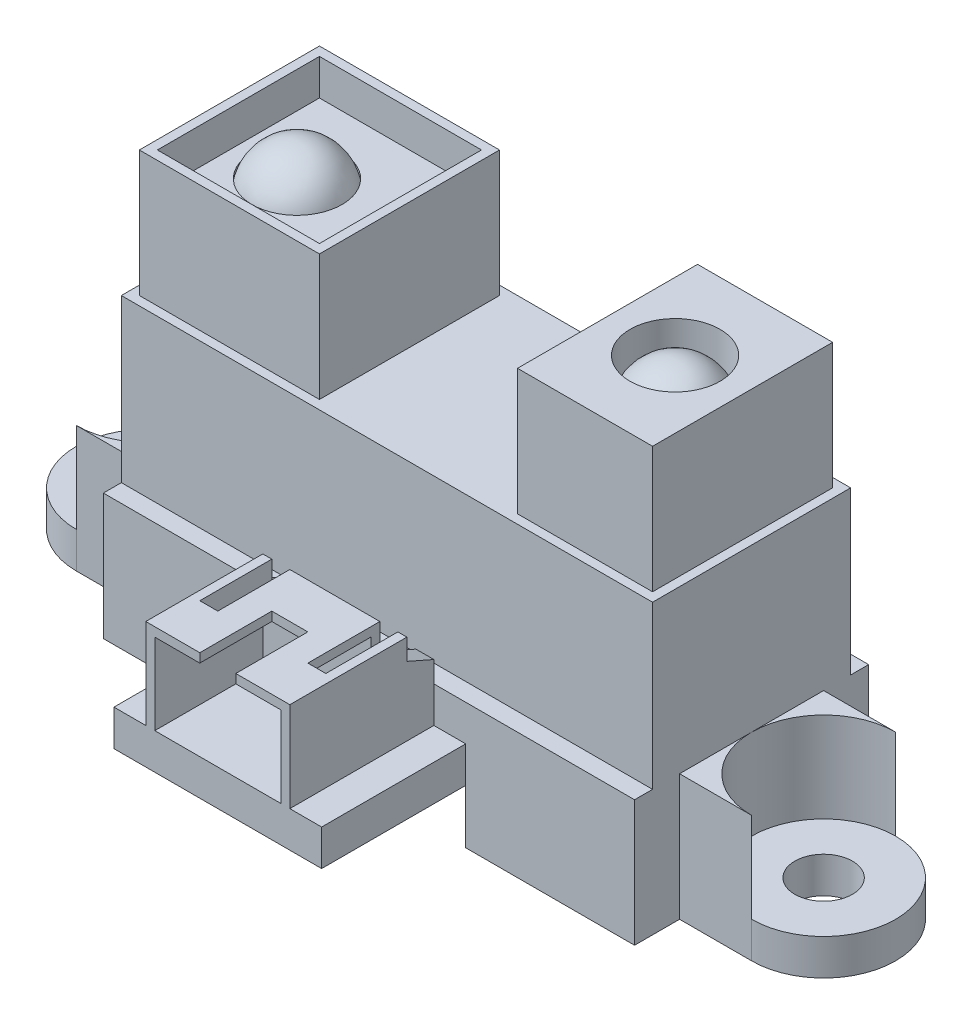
SolidWorks part; units mm, degrees
ref_plane "前视基准面" through (0, 0, 0) normal (0, 0, 1) x (1, 0, 0)
ref_plane "上视基准面" through (0, 0, 0) normal (0, 1, 0) x (1, 0, 0)
ref_plane "右视基准面" through (0, 0, 0) normal (1, 0, 0) x (0, 0, -1)
sketch "草图1" plane through (0, 0, 0) normal (0, 1, 0) x (1, 0, 0)
  line L0 (-8, -6.5) -> (37.5, -6.5) construction
  line L1 (0, 0) -> (29.5, 0)
  line L2 (0, 0) -> (0, -2.5)
  line L3 (0, -13) -> (29.5, -13)
  line L4 (29.5, 0) -> (29.5, -2.5)
  line L5 (-4, -2.5) -> (0, -2.5)
  line L6 (-4, -10.5) -> (0, -10.5)
  line L7 (33.5, -10.5) -> (29.5, -10.5)
  line L8 (33.5, -2.5) -> (29.5, -2.5)
  line L9 (0, -10.5) -> (0, -13)
  line L10 (29.5, -10.5) -> (29.5, -13)
  arc A0 (-4, -2.5) -> (-4, -10.5) centre (-4, -6.5) ccw
  arc A1 (33.5, -10.5) -> (33.5, -2.5) centre (33.5, -6.5) ccw
  dimension "D3" = 8
  dimension "D1" = 13
  dimension "D2" = 29.5
extrude "凸台-拉伸1" add sketch "草图1" along normal blind 7
sketch "草图2" plane through (0, 7, 0) normal (0, 1, 0) x (1, 0, 0)
  line L0 (14.75, 0) -> (14.75, -13) construction
  line L1 (29.5, 0) -> (0, 0) construction
  line L2 (0, -13) -> (29.5, -13) construction
  circle A0 centre (-4, -6.5) radius 4
  circle A1 centre (33.5, -6.5) radius 4
  dimension "D1" = 8
extrude "切除-拉伸1" cut sketch "草图2" against normal blind 5
sketch "草图3" plane through (0, 7, 0) normal (0, 1, 0) x (1, 0, 0)
  line L0 (-4, -6.5) -> (33.8058, -6.5) construction
  line L1 (0, -1) -> (29.5, -1)
  line L2 (0, -1) -> (0, -12)
  line L3 (0, -12) -> (29.5, -12)
  line L4 (29.5, -1) -> (29.5, -12)
  line L5 (14.75, 0) -> (14.75, -13) construction
  line L6 (29.5, 0) -> (0, 0) construction
  line L7 (0, -13) -> (29.5, -13) construction
  dimension "D1" = 11
  dimension "D2" = 29.5
extrude "凸台-拉伸2" add sketch "草图3" along normal blind 9
sketch "草图4" plane through (0, 16, 0) normal (0, 1, 0) x (1, 0, 0)
  line L4 (21.5, -1.5) -> (21.5, -11.5)
  line L5 (10.5, -1.5) -> (10.5, -11.5)
  line L6 (10.5, -1.5) -> (0.5, -1.5)
  line L7 (21.5, -11.5) -> (29, -11.5)
  line L8 (0.5, -1.5) -> (0.5, -11.5)
  line L9 (0.5, -11.5) -> (29, -11.5)
  line L10 (29, -11.5) -> (29, -1.5)
  line L11 (29, -1.5) -> (0.5, -1.5)
  line L12 (0.5, -1.5) -> (0.5, -11.5)
  line L13 (0.5, -11.5) -> (10.5, -11.5)
  line L14 (29, -11.5) -> (29, -1.5)
  line L15 (29, -1.5) -> (21.5, -1.5)
  dimension "D2" = 7.5
  dimension "D3" = 10
  dimension "D1" = 0.5
extrude "凸台-拉伸3" add sketch "草图4" along normal blind 7
sketch "草图5" plane through (0, 23, 0) normal (0, 1, 0) x (1, 0, 0)
  line L8 (1, -2) -> (1, -11)
  line L9 (1, -11) -> (10, -11)
  line L10 (10, -11) -> (10, -2)
  line L11 (10, -2) -> (1, -2)
  line L12 (1, -2) -> (1, -11)
  line L13 (1, -11) -> (10, -11)
  line L14 (10, -11) -> (10, -2)
  line L15 (10, -2) -> (1, -2)
  dimension "D1" = 0.5
extrude "切除-拉伸2" cut sketch "草图5" against normal blind 2
sketch "草图6" plane through (0, 23, 0) normal (0, 1, 0) x (1, 0, 0)
  line L0 (21.5, -1.5) -> (29, -11.5) construction
  line L1 (29, -11.5) -> (29, -1.5) construction
  line L2 (29, -1.5) -> (21.5, -11.5) construction
  circle A0 centre (25.25, -6.5) radius 2.5
  circle A1 centre (4.2533, -6.5) radius 2.5
  dimension "D1" = 5
  dimension "D2" = 20.9967
extrude "切除-拉伸3" cut sketch "草图6" against normal blind 2.2
dome "圆顶1" faces to dome 2 distance 2 parameters "D1"=2
dome "圆顶2" faces to dome 2 distance 2 parameters "D1"=2
sketch "草图7" plane through (0, 2, 0) normal (0, 1, 0) x (1, 0, 0)
  circle A0 centre (-4, -6.5) radius 1.6
  circle A1 centre (33.5, -6.5) radius 1.6
  dimension "D1" = 3.2
extrude "切除-拉伸4" cut sketch "草图7" against normal through all
sketch "草图8" plane through (0, 0, 13) normal (0, 0, 1) x (1, 0, 0)
  line L0 (8.5891, 0) -> (20.1229, 0)
  line L1 (8.5891, 5) -> (20.1229, 5)
  line L2 (8.5891, 5) -> (8.5891, 0)
  line L4 (20.1229, 5) -> (20.1229, 0)
  dimension "D1" = 5
extrude "凸台-拉伸4" add sketch "草图8" along normal blind 8
sketch "草图10" plane through (0, 0, 0) normal (0, -1, 0) x (1, 0, 0)
  line L14 (8.5891, 21) -> (8.5891, 12)
  line L15 (8.5891, 21) -> (20.1229, 21)
  line L16 (20.1229, 21) -> (20.1229, 12)
  line L17 (1, 12) -> (1, 1)
  line L18 (28.5, 1) -> (28.5, 12)
  line L28 (1, 3.5) -> (1, 1)
  line L29 (1, 1) -> (28.5, 1)
  line L30 (28.5, 1) -> (28.5, 3.5)
  line L31 (28.5, 3.5) -> (33.5, 3.5)
  line L32 (33.5, 9.5) -> (28.5, 9.5)
  line L33 (28.5, 9.5) -> (28.5, 12)
  line L34 (28.5, 12) -> (19.1229, 12)
  line L35 (19.1229, 12) -> (19.1229, 20)
  line L36 (19.1229, 20) -> (9.5891, 20)
  line L37 (9.5891, 20) -> (9.5891, 12)
  line L38 (9.5891, 12) -> (1, 12)
  line L39 (1, 12) -> (1, 9.5)
  line L40 (1, 9.5) -> (-4, 9.5)
  line L41 (-4, 3.5) -> (1, 3.5)
  line L43 (1, 1) -> (28.5, 1)
  line L48 (28.5, 12) -> (20.1229, 12)
  line L52 (8.5891, 12) -> (1, 12)
  arc A4 (33.5, 3.5) -> (33.5, 9.5) centre (33.5, 6.5) ccw
  arc A5 (-4, 9.5) -> (-4, 3.5) centre (-4, 6.5) ccw
  dimension "D1" = 1
extrude "切除-拉伸5" cut sketch "草图10" against normal blind 3
sketch "草图11" plane through (0, 5, 0) normal (0, 1, 0) x (1, 0, 0)
  line L0 (14.356, -13) -> (14.356, -21) construction
  line L1 (20.1229, -13) -> (8.5891, -13) construction
  line L2 (20.1229, -21) -> (8.5891, -21) construction
  line L3 (10.356, -14.5) -> (10.356, -21)
  line L4 (18.356, -14.5) -> (18.356, -21)
  line L6 (10.356, -13) -> (10.356, -21) construction
  line L7 (20.1229, -14.5) -> (8.5891, -14.5)
  line L8 (18.356, -14.5) -> (10.356, -14.5)
  line L9 (18.356, -13) -> (18.356, -21) construction
  line L10 (10.356, -21) -> (18.356, -21)
  dimension "D1" = 4
  dimension "D2" = 4
  dimension "D3" = 1.5
extrude "凸台-拉伸6" add sketch "草图11" along normal blind 5
sketch "草图12" plane through (18.356, 0, 0) normal (1, 0, 0) x (0, 0, -1)
  line L0 (-14.5, 8.8329) -> (-13, 8.1725)
  line L1 (-14.5, 10) -> (-14.5, 5) construction
  line L2 (-13, 8.1725) -> (-13, 5)
  line L3 (-13, 5) -> (-14.5, 5)
  line L4 (-14.5, 5) -> (-14.5, 8.8329)
extrude "凸台-拉伸7" add sketch "草图12" against normal blind 1
sketch "草图13" plane through (10.356, 0, 0) normal (-1, 0, 0) x (0, 0, 1)
  line L0 (14.5, 8.8329) -> (13, 8.1725)
  line L1 (13, 8.1725) -> (13, 5)
  line L2 (13, 5) -> (14.5, 5)
  line L3 (14.5, 5) -> (14.5, 8.8329)
extrude "凸台-拉伸8" add sketch "草图13" against normal blind 1
sketch "草图14" plane through (0, 0, 21) normal (0, 0, 1) x (1, 0, 0)
  line L8 (10.856, 5) -> (17.856, 5)
  line L11 (13.356, 10) -> (13.356, 9.5)
  line L12 (15.356, 10) -> (15.356, 9.5)
  line L13 (13.356, 10) -> (15.356, 10)
  line L15 (13.356, 9.5) -> (10.856, 9.5)
  line L16 (9.0891, 3.5) -> (19.6229, 3.5)
  line L17 (19.6229, 3.5) -> (19.6229, 4.5)
  line L18 (19.6229, 4.5) -> (17.856, 4.5)
  line L19 (17.856, 4.5) -> (17.856, 9.5)
  line L20 (17.856, 9.5) -> (10.856, 9.5)
  line L21 (10.856, 9.5) -> (10.856, 4.5)
  line L22 (10.856, 4.5) -> (9.0891, 4.5)
  line L23 (9.0891, 4.5) -> (9.0891, 3.5)
  line L27 (17.856, 5) -> (17.856, 9.5)
  line L28 (17.856, 9.5) -> (15.356, 9.5)
  line L29 (10.856, 9.5) -> (10.856, 5)
  dimension "D1" = 0.5
extrude "切除-拉伸6" cut sketch "草图14" against normal blind 4
sketch "草图15" plane through (0, 0, 17) normal (0, 0, 1) x (1, 0, 0)
  line L1 (10.856, 9.5) -> (17.856, 9.5)
  line L2 (10.856, 9.5) -> (10.856, 5)
  line L3 (10.856, 5) -> (17.856, 5)
  line L4 (17.856, 9.5) -> (17.856, 5)
extrude "切除-拉伸7" cut sketch "草图15" against normal blind 2
sketch "草图16" plane through (0, 10, 0) normal (0, 1, 0) x (1, 0, 0)
  line L10 (10.856, -13) -> (10.856, -21)
  line L11 (10.856, -14.5) -> (10.856, -18.5)
  line L12 (11.856, -14.5) -> (11.856, -18.5)
  line L13 (17.856, -21) -> (17.856, -13)
  line L14 (17.856, -18.5) -> (17.856, -14.5)
  line L15 (16.856, -18.5) -> (16.856, -14.5)
  line L16 (10.856, -14.5) -> (11.856, -14.5)
  line L17 (17.856, -21) -> (17.856, -13) construction
  line L18 (16.856, -21) -> (16.856, -13) construction
  line L19 (16.856, -14.5) -> (17.856, -14.5)
  line L20 (11.856, -13) -> (11.856, -21) construction
  line L21 (10.856, -13) -> (10.856, -21) construction
  line L23 (16.856, -18.5) -> (17.856, -18.5)
  line L24 (10.856, -18.5) -> (17.856, -18.5)
  line L25 (10.856, -18.5) -> (11.856, -18.5)
  dimension "D1" = 0.5
  dimension "D2" = 0.5
  dimension "D3" = 1
  dimension "D4" = 2.5
extrude "切除-拉伸8" cut sketch "草图16" against normal blind 1
sketch "草图18" plane through (0, 7, 0) normal (0, 1, 0) x (1, 0, 0)
  line L1 (0, 0) -> (29.5, 0)
  line L2 (0, 0) -> (0, -13)
  line L3 (0, -13) -> (29.5, -13)
  line L4 (29.5, 0) -> (29.5, -13)
extrude "凸台-拉伸9" [suppressed] add sketch "草图18" along normal blind 300
